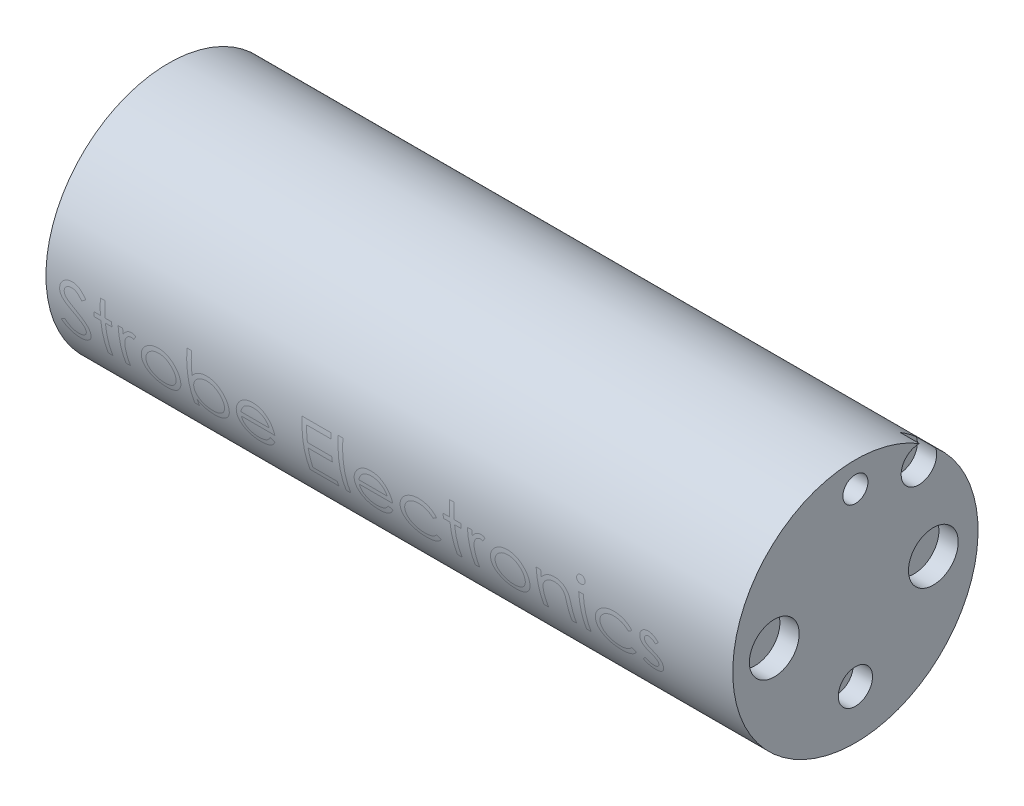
SolidWorks part; units mm, degrees
ref_plane "Front Plane" through (0, 0, 0) normal (0, 0, 1) x (1, 0, 0)
ref_plane "Top Plane" through (0, 0, 0) normal (0, 1, 0) x (1, 0, 0)
ref_plane "Right Plane" through (0, 0, 0) normal (1, 0, 0) x (0, 0, -1)
sketch "Sketch1" plane through (0, 0, 0) normal (1, 0, 0) x (0, 0, -1)
  circle A0 centre (0, 0) radius 63.5
  dimension "D1" = 127
extrude "Boss-Extrude1" add sketch "Sketch1" along normal blind 355.6
sketch "Sketch2" plane through (355.6, 0, 0) normal (1, 0, 0) x (0, 0, -1)
  circle A0 centre (0, 50.3305) radius 6.5096
  circle A1 centre (40.3467, 0) radius 12.8838
  circle A2 centre (-41.9935, 0) radius 12.8986
  circle A3 centre (0, -38.1853) radius 8.8683
  circle A4 centre (32.8723, 44.9918) radius 9.1853
sketch "Sketch3" plane through (0, 0, 0) normal (0, 0, 1) x (1, 0, 0)
  text T0 "Strobe Electronics" font "Century Gothic" height in points 100
wrap "Wrap1" sketch "Sketch3" wrap type scribe source sketch "Sketch3"
extrude "Cut-Extrude1" cut sketch "Sketch2" against normal blind 10
